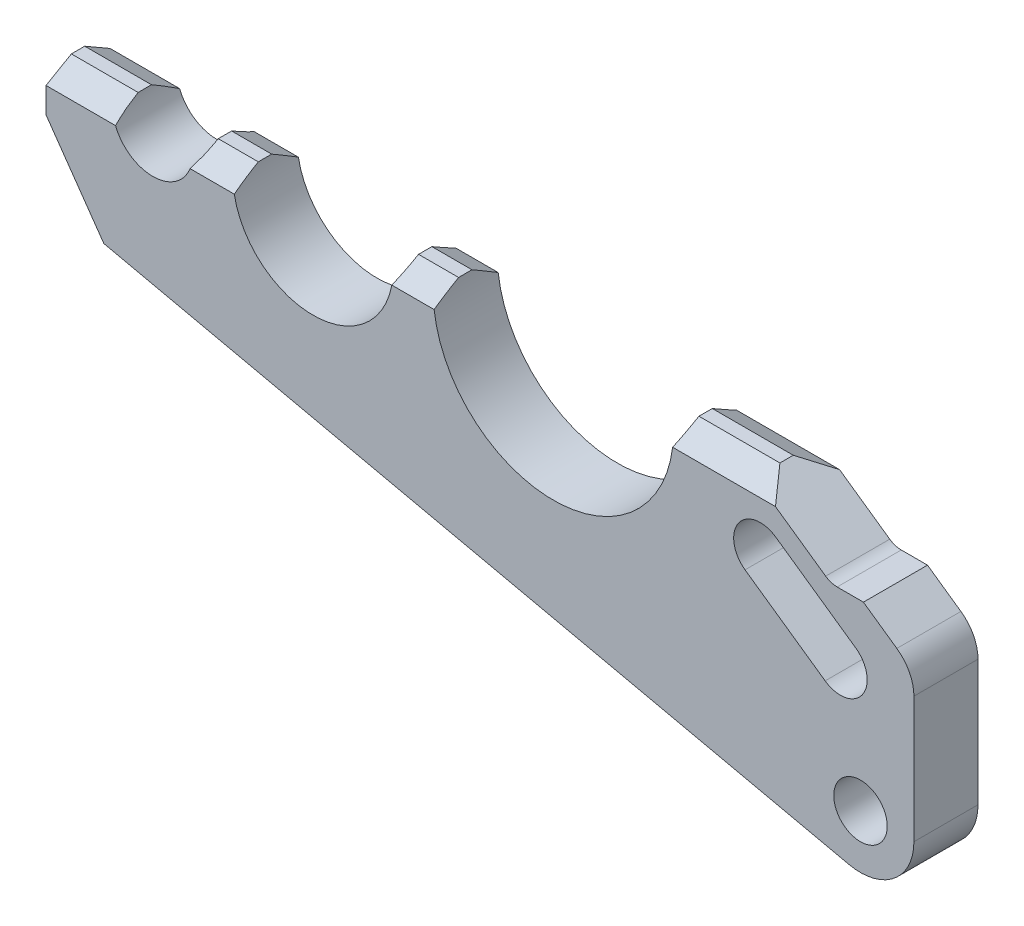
SolidWorks part; units mm, degrees
ref_plane "Front Plane" through (0, 0, 0) normal (0, 0, 1) x (1, 0, 0)
ref_plane "Top Plane" through (0, 0, 0) normal (0, 1, 0) x (1, 0, 0)
ref_plane "Right Plane" through (0, 0, 0) normal (1, 0, 0) x (0, 0, -1)
sketch "Sketch2" plane through (0, 0, 0) normal (0, 0, 1) x (1, 0, 0)
  line L0 (94.4234, 53.6072) -> (91.922, 55.3587)
  line L1 (95.7027, 41.7087) -> (95.7027, 51.1497)
  line L2 (35.0326, 50.1751) -> (90.837, 37.8035)
  line L3 (30.7027, 56.3587) -> (35.0326, 50.1751)
  line L4 (30.7027, 58.204) -> (30.7027, 56.3587)
  line L5 (35.9338, 58.204) -> (30.7365, 58.204)
  line L6 (44.8149, 58.204) -> (41.5402, 58.204)
  line L7 (59.7771, 58.204) -> (56.6272, 58.204)
  line L8 (85.4177, 58.204) -> (77.6739, 58.204)
  line L9 (91.922, 55.3587) -> (89.9542, 55.3587)
  line L10 (41.7027, 59.3587) -> (44.7027, 59.3587)
  line L11 (56.7027, 59.3587) -> (59.7027, 59.3587)
  line L12 (30.7027, 58.204) -> (30.7027, 59.3587)
  line L13 (30.7027, 59.3587) -> (35.7027, 59.3587)
  line L14 (77.7027, 59.3587) -> (83.7686, 59.3587)
  line L15 (83.0556, 53.0217) -> (89.0556, 48.8204)
  line L16 (85.3499, 56.2983) -> (91.3499, 52.097)
  line L17 (83.7686, 59.3587) -> (89.0938, 55.63)
  circle A0 centre (91.7027, 41.7087) radius 2
  arc A1 (95.7027, 51.1497) -> (94.4234, 53.6072) centre (92.7027, 51.1497) ccw
  arc A2 (90.837, 37.8035) -> (95.7027, 41.7087) centre (91.7027, 41.7087) ccw
  arc A3 (35.9338, 58.204) -> (41.4716, 58.204) centre (38.7027, 59.3587) ccw
  arc A4 (44.8149, 58.204) -> (56.5906, 58.204) centre (50.7027, 59.3587) ccw
  arc A5 (59.7771, 58.204) -> (77.6283, 58.204) centre (68.7027, 59.3587) ccw
  arc A6 (44.7027, 59.3587) -> (44.8149, 58.204) centre (50.7027, 59.3587) ccw
  arc A7 (41.4716, 58.204) -> (41.7027, 59.3587) centre (38.7027, 59.3587) ccw
  arc A8 (59.7027, 59.3587) -> (59.7771, 58.204) centre (68.7027, 59.3587) ccw
  arc A9 (56.5906, 58.204) -> (56.7027, 59.3587) centre (50.7027, 59.3587) ccw
  arc A10 (35.7027, 59.3587) -> (35.9338, 58.204) centre (38.7027, 59.3587) ccw
  arc A11 (77.6283, 58.204) -> (77.7027, 59.3587) centre (68.7027, 59.3587) ccw
  arc A12 (85.3499, 56.2983) -> (83.0556, 53.0217) centre (84.2027, 54.66) ccw
  arc A13 (89.0556, 48.8204) -> (91.3499, 52.097) centre (90.2027, 50.4587) ccw
  arc A14 (89.0938, 55.63) -> (89.9542, 55.3587) centre (89.9542, 56.8587) ccw
sketch "Sketch3" plane through (117.0367, 0, 0) normal (1, 0, 0) x (0, 0, -1)
  line L0 (0, 37.7087) -> (4.8, 37.7087)
  line L1 (4.8, 55.3587) -> (0, 55.3587)
  line L2 (1.9, 59.3587) -> (0, 58.2617)
  line L3 (1.9, 59.3587) -> (2.9, 59.3587)
  line L4 (4.8, 58.2617) -> (2.9, 59.3587)
  line L5 (0, 58.2617) -> (0, 37.7087)
  line L6 (4.8, 37.7087) -> (4.8, 58.2617)
extrude "Extrude1" add sketch "Sketch2" against normal up to vertex (4.8 mm away)
extrude "Cut-Extrude1" cut sketch "Sketch3" against normal through all flip side to cut contours L5 L0 L6 L4 L3 L2
